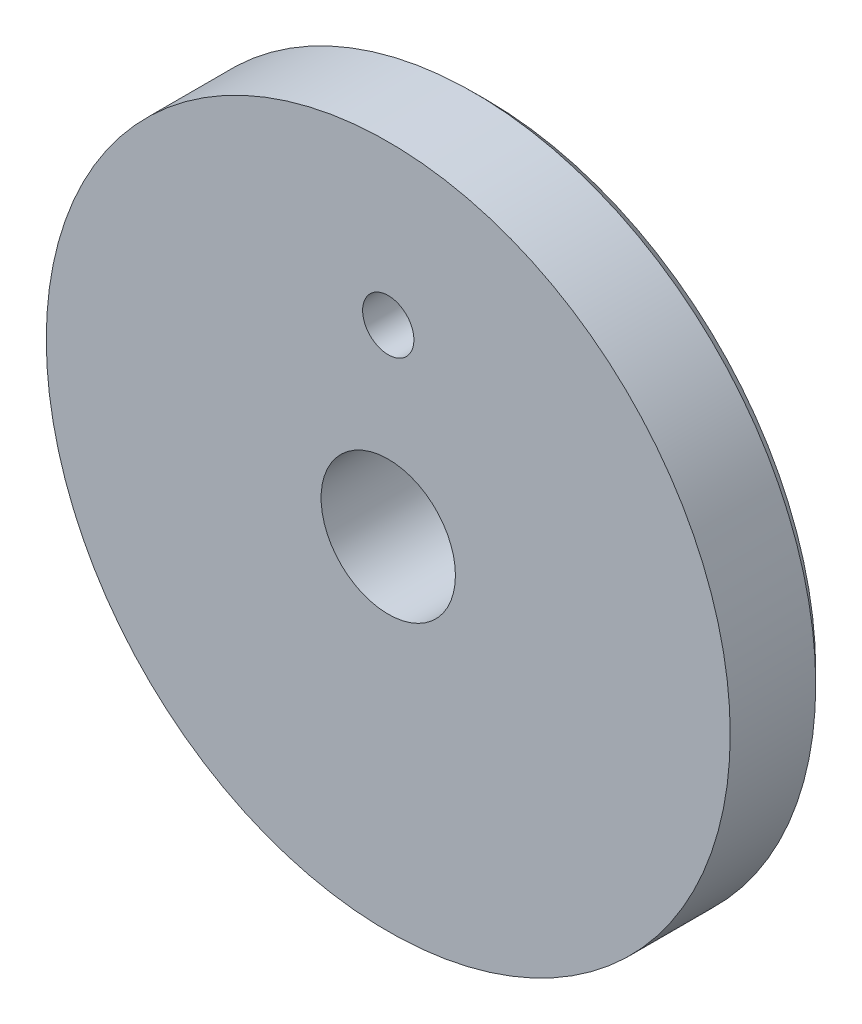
SolidWorks part; units mm, degrees
ref_plane "Front" through (0, 0, 0) normal (0, 0, 1) x (1, 0, 0)
ref_plane "Top" through (0, 0, 0) normal (0, 1, 0) x (1, 0, 0)
ref_plane "Right" through (0, 0, 0) normal (1, 0, 0) x (0, 0, -1)
other "Configuration Table"
sketch "Sketch1" plane through (0, 0, 0) normal (0, 0, 1) x (1, 0, 0)
  circle A0 centre (0, 0) radius 14
  circle A1 centre (0, 0) radius 2.75
  dimension "d" = 5.5
  dimension "D0" = 28
extrude "Base-Extrude" add sketch "Sketch1" against normal blind 4
sketch "Sketch2" plane through (7.2492, 0.3213, -4) normal (0, 0, -1) x (-1, 0, 0)
  circle A0 centre (7.2492, 7.1787) radius 1.05
  circle A1 centre (7.2492, -0.3213) radius 2.75 construction
  circle A2 centre (7.2492, -0.3213) radius 2.75 construction
  dimension "d1" = 2.1
  dimension "L" = 7.5
extrude "Hole" cut sketch "Sketch2" against normal through all
chamfer "Chamfer1" distance 0.5 angle 45 1 edges at (14, 0, -4)
